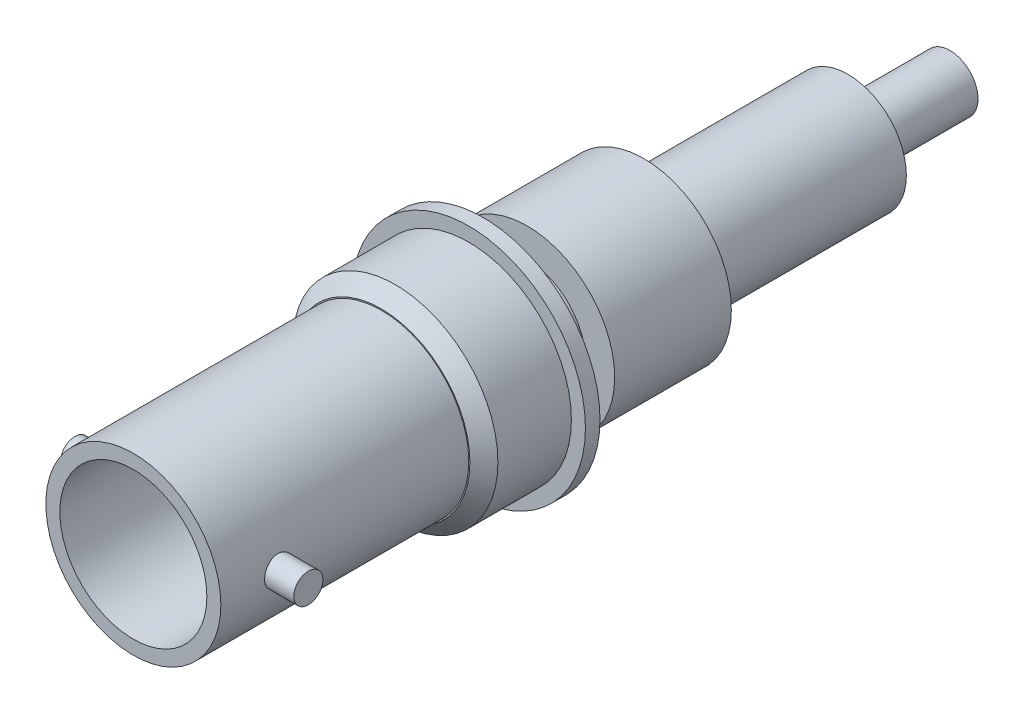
SolidWorks part; units mm, degrees
ref_plane "Front" through (0, 0, 0) normal (0, 0, 1) x (1, 0, 0)
ref_plane "Top" through (0, 0, 0) normal (0, 1, 0) x (1, 0, 0)
ref_plane "Right" through (0, 0, 0) normal (1, 0, 0) x (0, 0, -1)
sketch "Sketch1" plane through (0, 0, 0) normal (0, 0, 1) x (1, 0, 0)
  circle A0 centre (0, 0) radius 6.35
  dimension "D1" = 12.7
extrude "Extrude1" add sketch "Sketch1" along normal blind 0.7937
sketch "Sketch2" plane through (0, 0, 0.7937) normal (0, 0, 1) x (1, 0, 0)
  circle A0 centre (0, 0) radius 4.7625
  dimension "D1" = 9.525
extrude "Extrude-Thin1" add sketch "Sketch2" along normal blind 18.2562 thin
sketch "Sketch3" plane through (0, 0, 0) normal (1, 0, 0) x (0, 0, -1)
  line L0 (-19.05, 4.7625) -> (-19.05, -4.7625) construction
  circle A0 centre (-15.875, 0) radius 0.7937
  dimension "D2" = 1.5875
  dimension "D1" = 3.175
extrude "Extrude2" add sketch "Sketch3" along normal mid plane 12.7
sketch "Sketch4" plane through (0, 0, 19.05) normal (0, 0, 1) x (1, 0, 0)
  circle A0 centre (0, 0) radius 4.0005 construction
  circle A1 centre (0, 0) radius 4.0005
extrude "Cut-Extrude1" cut sketch "Sketch4" against normal through all
sketch "Sketch5" plane through (0, 0, 0.7937) normal (0, 0, 1) x (1, 0, 0)
  circle A0 centre (0, 0) radius 5.588
  circle A1 centre (0, 0) radius 4.0005
  circle A2 centre (0, 0) radius 4.0005 construction
  dimension "D1" = 1.5875
extrude "Extrude3" add sketch "Sketch5" along normal blind 4.7625
chamfer "Chamfer1" distance 0.762 angle 45 1 edges at (5.588, 0, 5.5563)
sketch "Sketch6" plane through (0, 0, 0) normal (0, 1, 0) x (1, 0, 0)
  line L0 (0, 0) -> (0, 25.4)
  line L1 (0, 25.4) -> (1.524, 25.4)
  line L2 (1.524, 25.4) -> (1.524, 19.8501)
  line L3 (1.524, 19.8501) -> (3.175, 19.8501)
  line L4 (3.175, 19.8501) -> (3.175, 8.7376)
  line L5 (3.175, 8.7376) -> (4.7625, 8.7376)
  line L6 (4.7625, 8.7376) -> (4.7625, 2.3876)
  line L7 (4.7625, 2.3876) -> (3.175, 2.3876)
  line L8 (3.175, 2.3876) -> (3.175, 0.8128)
  line L9 (3.175, 0.8128) -> (4.7625, 0.8128)
  line L10 (4.7625, 0.8128) -> (4.7625, 0)
  line L11 (4.0005, 0) -> (-4.0005, 0) construction
  line L12 (4.7625, 0) -> (0, 0)
  dimension "D1" = 25.4
  dimension "D2" = 0.8128
  dimension "D3" = 1.5748
  dimension "D4" = 6.35
  dimension "D5" = 11.1125
  dimension "D6" = 3.175
  dimension "D7" = 4.7625
  dimension "D8" = 3.175
  dimension "D9" = 1.524
revolve "Revolve1" add sketch "Sketch6" angle 360 about L0
